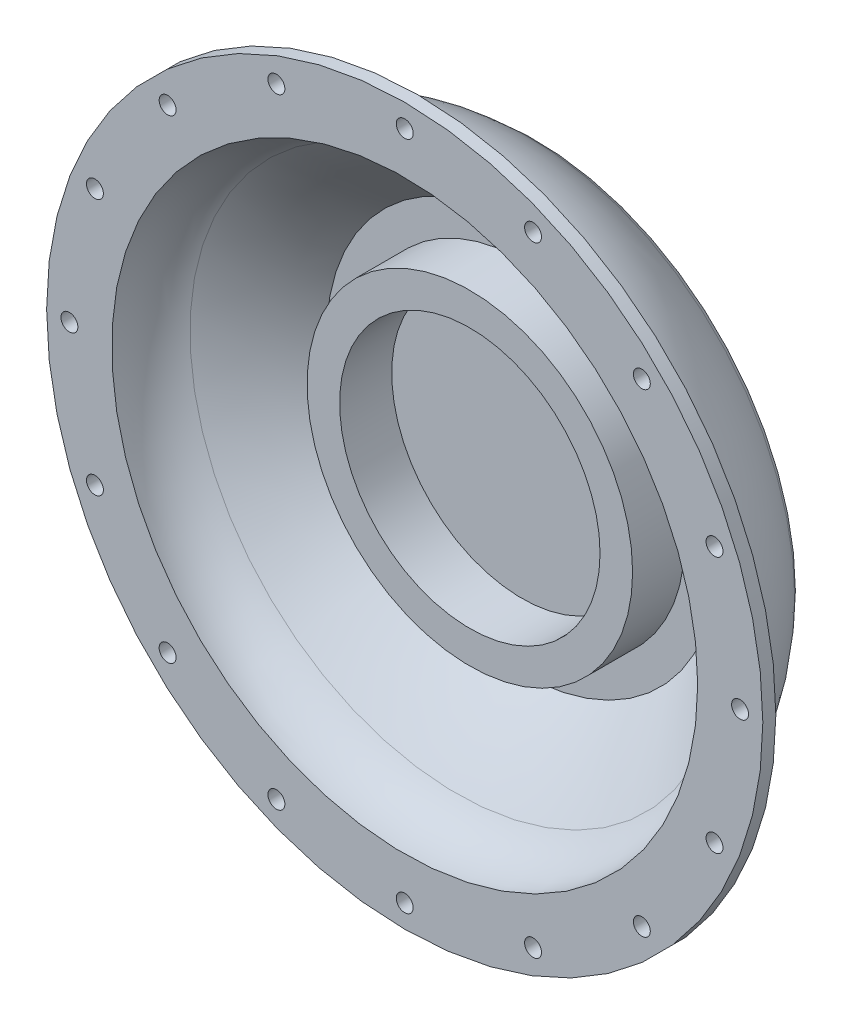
SolidWorks part; units mm, degrees
ref_plane "Alzado" through (0, 0, 0) normal (0, 0, 1) x (1, 0, 0)
ref_plane "Planta" through (0, 0, 0) normal (0, 1, 0) x (1, 0, 0)
ref_plane "Vista lateral" through (0, 0, 0) normal (1, 0, 0) x (0, 0, -1)
sketch "Croquis1" plane through (0, 0, 0) normal (1, 0, 0) x (0, 0, -1)
  line L0 (0, 55) -> (0, 45)
  line L1 (18, 25) -> (10, 25)
  line L2 (10, 25) -> (10, 20)
  line L4 (20, 0) -> (20, 40)
  line L5 (2, 47.561) -> (2, 55)
  line L6 (2, 55) -> (0, 55)
  line L7 (10, 20) -> (18, 20)
  line L8 (18, 20) -> (18, 0)
  line L9 (18, 0) -> (20, 0)
  line L10 (18, 25) -> (18, 30)
  line L11 (0, 0) -> (58.2059, 0) construction
  arc A3 (0, 45) -> (8.006, 40.992) centre (0, 35) cw
  arc A4 (8.006, 40.992) -> (18, 30) centre (70.4527, 87.7297) ccw
  arc A5 (2, 47.561) -> (19.1187, 40.7805) centre (2, 22.561) cw
  arc A6 (19.1187, 40.7805) -> (20, 40) centre (32.8137, 55.3561) ccw
  dimension "D1" = 110
  dimension "D6" = 25
  dimension "D7" = 10
  dimension "D8" = 78
  dimension "D9" = 20
  dimension "D16" = 47.561
  dimension "D2" = 20
  dimension "D3" = 18
  dimension "D4" = 90
  dimension "D5" = 2
  dimension "D10" = 10
  dimension "D11" = 18
  dimension "D12" = 40
  dimension "D13" = 50
  dimension "D14" = 30
  dimension "D15" = 40
revolve "Revolución1" add sketch "Croquis1" angle 360 about L11
hole_wizard "Taladro de margen para M21" positions "Croquis5" profile "Croquis3" hole size "M2" standard "Ansi Metric"
sketch "Croquis5" plane through (0, 0, -2) normal (0, 0, -1) x (-1, 0, 0)
  circle A0 centre (0, 0) radius 51.5 construction
  point P0 (-51.5, 0)
  dimension "D1" = 103
sketch "Croquis3" plane through (51.5, 0, -2) normal (1, 0, 0) x (0, 1, 0)
  line L0 (0, 0) -> (0, 2)
  line L1 (0, 2) -> (1.3, 2)
  line L2 (1.3, 2) -> (1.3, 0)
  line L5 (1.3, 0) -> (0, 0)
  line L11 (0, -6.35) -> (0, 107.95) construction
  dimension "Diámetro de taladro hasta el siguiente" = 2.6
  dimension "Profundidad de taladro hasta el siguiente" = 2
pattern_circular "MatrizC1" count 16 over 360 about axis through (0, 0, 0) along (0, 0, 1) of "Taladro de margen para M21"
